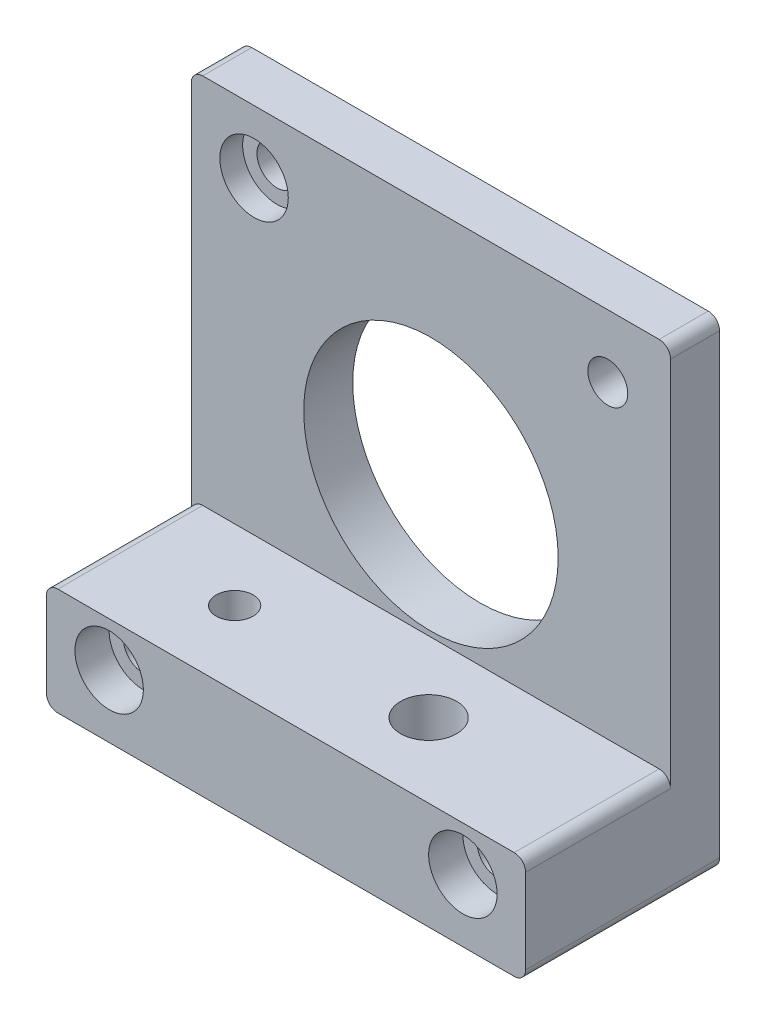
SolidWorks part; units mm, degrees
ref_plane "Alzado" through (0, 0, 0) normal (0, 0, 1) x (1, 0, 0)
ref_plane "Planta" through (0, 0, 0) normal (0, 1, 0) x (1, 0, 0)
ref_plane "Vista lateral" through (0, 0, 0) normal (1, 0, 0) x (0, 0, -1)
imported_body "Imported1"
move or copy body "Body-Move/Copy1" bodies to move or copy 102
